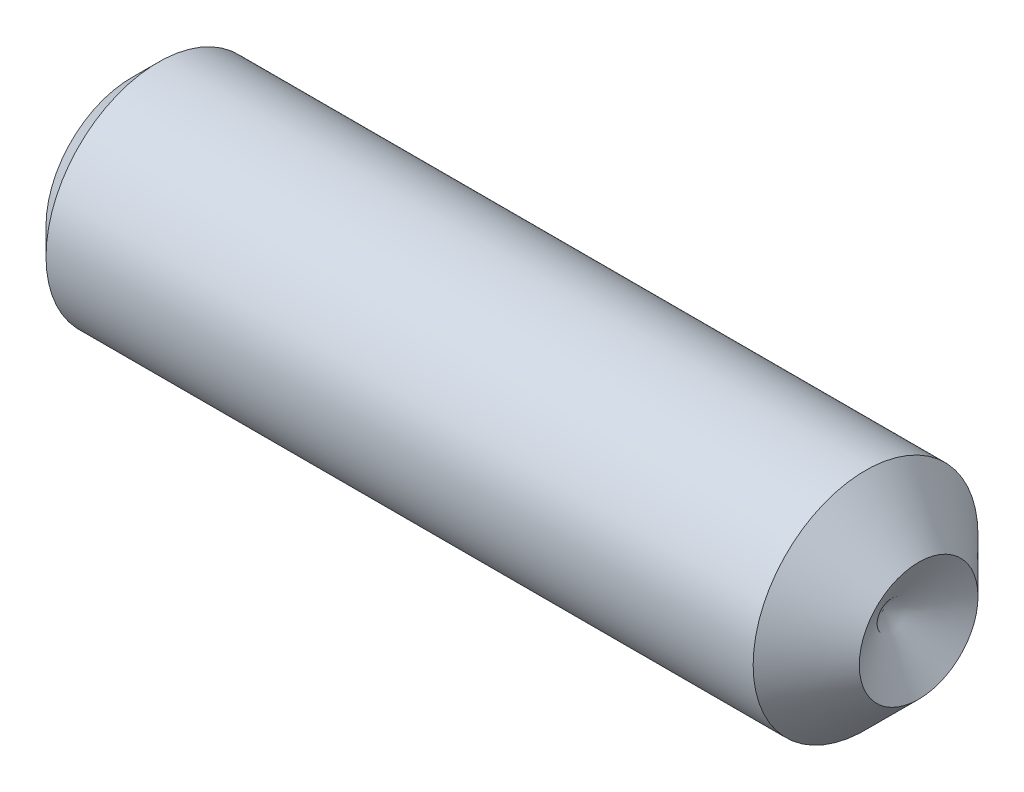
SolidWorks part; units mm, degrees
ref_plane "Plane1" through (0, 0, 0) normal (0, 0, 1) x (1, 0, 0)
ref_plane "Plane2" through (0, 0, 0) normal (0, 1, 0) x (1, 0, 0)
ref_plane "Plane3" through (0, 0, 0) normal (1, 0, 0) x (0, 0, -1)
sketch "BodySke" plane through (0, 0, 0) normal (0, 0, 1) x (1, 0, 0)
  line L0 (0, 0) -> (0, 2.4194)
  line L1 (0, 2.4194) -> (0.7557, 3.175)
  line L2 (0.7557, 3.175) -> (20.7264, 3.175)
  line L3 (20.7264, 3.175) -> (22.225, 1.6764)
  line L4 (21.2177, 0) -> (0, 0)
  line L5 (-12.7, 0) -> (88.9, 0) construction
  line L6 (21.2177, 0) -> (22.225, 1.6764)
  line L7 (22.225, 1.6764) -> (22.225, 11.2014) construction
  line L8 (0, -2.4193) -> (0.7557, -3.175) construction
  line L9 (21.2177, 0) -> (22.225, -1.6764) construction
  line L10 (20.7264, -3.175) -> (22.225, -1.6764) construction
  line L11 (1.27, 15.875) -> (1.27, -3.175) construction
  dimension "Length" = 22.225
  dimension "Diameter" = 6.35
  dimension "Drive_ch_ang" = 45
  dimension "Minor_dia" = 4.8387
  dimension "Cup_nose_ang" = 45
  dimension "Cup_ang" = 118
  dimension "Cup_dia" = 3.3528
  dimension "Advance" = 1.27
revolve "BaseBody" add sketch "BodySke" angle 360 about L5
sketch "Sketch2" plane through (0, 0, 0) normal (-1, 0, 0) x (0, 0, 1)
  line L0 (0.9165, 1.5875) -> (-0.9165, 1.5875)
  line L1 (-0.9165, 1.5875) -> (-1.8331, 0)
  line L2 (0.9165, 1.5875) -> (1.8331, 0)
  line L3 (0.9165, -1.5875) -> (1.8331, 0)
  line L4 (0.9165, -1.5875) -> (-0.9165, -1.5875)
  line L5 (-0.9165, -1.5875) -> (-1.8331, 0)
  dimension "Hex_size" = 3.175
  dimension "D2" = 1.5875
  dimension "D3" = 1.5875
extrude "Hex" cut sketch "Sketch2" against normal blind 3.175
sketch "Sketch4" plane through (0, 4.7709, -0.5249) normal (-1, 0, 0) x (0, 0, 1)
  line L0 (0.5249, -4.7709) -> (2.4172, -4.7709)
  line L1 (0.5249, -4.7709) -> (6.6732, -1.2211) construction
  line L2 (0.5249, -4.7709) -> (1.471, -3.1321)
  line L3 (2.0912, -4.3358) -> (2.3286, -4.1988)
  line L4 (1.6848, -3.6319) -> (1.9222, -3.4948)
  arc A0 (2.0912, -4.3358) -> (1.6848, -3.6319) centre (0.5249, -4.7709) ccw
  arc A1 (2.4172, -4.7709) -> (2.3286, -4.1988) centre (0.5249, -4.7709) ccw
  arc A2 (1.471, -3.1321) -> (1.9222, -3.4948) centre (0.5249, -4.7709) cw
  circle A3 centre (0.5249, -4.7709) radius 1.6256 construction
  circle A4 centre (0.5249, -4.7709) radius 1.8923 construction
  dimension "D1" = 30
  dimension "Spline_n_dim" = 3.2512
  dimension "Spline_m_dim" = 3.7846
  dimension "Spline_a_dim" = 60
  dimension "D3" = 0.4064
  dimension "Spline_p_dim" = 0.8128
extrude "Spline" [suppressed] cut sketch "Sketch4" against normal blind 3.175
pattern_circular "CirPattern1" [suppressed] count 6 every 60 about axis through (-12.7, 0, 0) along (1, 0, 0)
sketch "ThdSchSke" plane through (0, 0, 0) normal (0, 0, 1) x (1, 0, 0)
  line L0 (0.7557, -2.4193) -> (0.2265, -3.175)
  line L1 (0.7557, -2.4193) -> (1.2848, -3.175)
  line L2 (1.2848, -3.175) -> (1.2848, -3.9688)
  line L3 (-3.175, 0) -> (5.1513, 0) construction
  line L4 (0.7557, 3.175) -> (0.7557, -3.175) construction
  line L5 (1.2848, -3.9688) -> (0.2265, -3.9688)
  line L6 (0.2265, -3.9688) -> (0.2265, -3.175)
  dimension "Thread_minor" = 4.8387
  dimension "Diameter" = 6.35
  dimension "SideAngle" = 55
  dimension "VeeAngle" = 70
  dimension "Overcut" = 7.9375
revolve "ThreadSchematic" [suppressed] cut sketch "ThdSchSke" angle 360 about L3
pattern_linear "ThdSchPat" [suppressed]
equation "\"D2@Sketch2\" = \"Hex_size@Sketch2\" / 2"
equation "\"D3@Sketch2\" = \"Hex_size@Sketch2\" / 2"
equation "\"Thread_minor@ThreadCosmetic\" = \"Minor_dia@BodySke\""
equation "\"D1@Sketch4\" = \"Spline_a_dim@Sketch4\" / 2"
equation "\"D3@Sketch4\" = \"Spline_p_dim@Sketch4\" / 2"
equation "\"D2@CirPattern1\" = \"Spline_a_dim@Sketch4\""
equation "\"Num_teeth@CirPattern1\" = 360 / \"D2@CirPattern1\""
equation "\"Thread_minor@ThdSchSke\" = \"Thread_minor@ThreadCosmetic\""
equation "\"Diameter@ThdSchSke\" = \"Diameter@BodySke\""
equation "\"Overcut@ThdSchSke\" = \"Diameter@BodySke\" * 1.25"
equation "\"Num_threads@ThdSchPat\" = int( (\"Length@BodySke\" - ( ( ( \"Diameter@BodySke\" - \"Minor_dia@BodySke\" ) * 0.5 ) / tan( \"Drive_ch_ang@BodySke\" ) ) - ( ( ( \"Diameter@BodySke\" - \"Cup_dia@BodySke\" ) * 0.5 ) *"
equation "\"Advance@ThdSchPat\" = (\"Length@BodySke\" - ( ( ( \"Diameter@BodySke\" - \"Minor_dia@BodySke\" ) * 0.5 ) / tan( \"Drive_ch_ang@BodySke\" ) ) - ( ( ( \"Diameter@BodySke\" - \"Cup_dia@BodySke\" ) * 0.5 ) * tan( \"Cu"
equation "' \"Num_threads@ThdSchPat\" = \"Num_threads@ThdSchPat\" - sgn( \"Num_threads@ThdSchPat\" - 1) '---chamfered tips only---"
